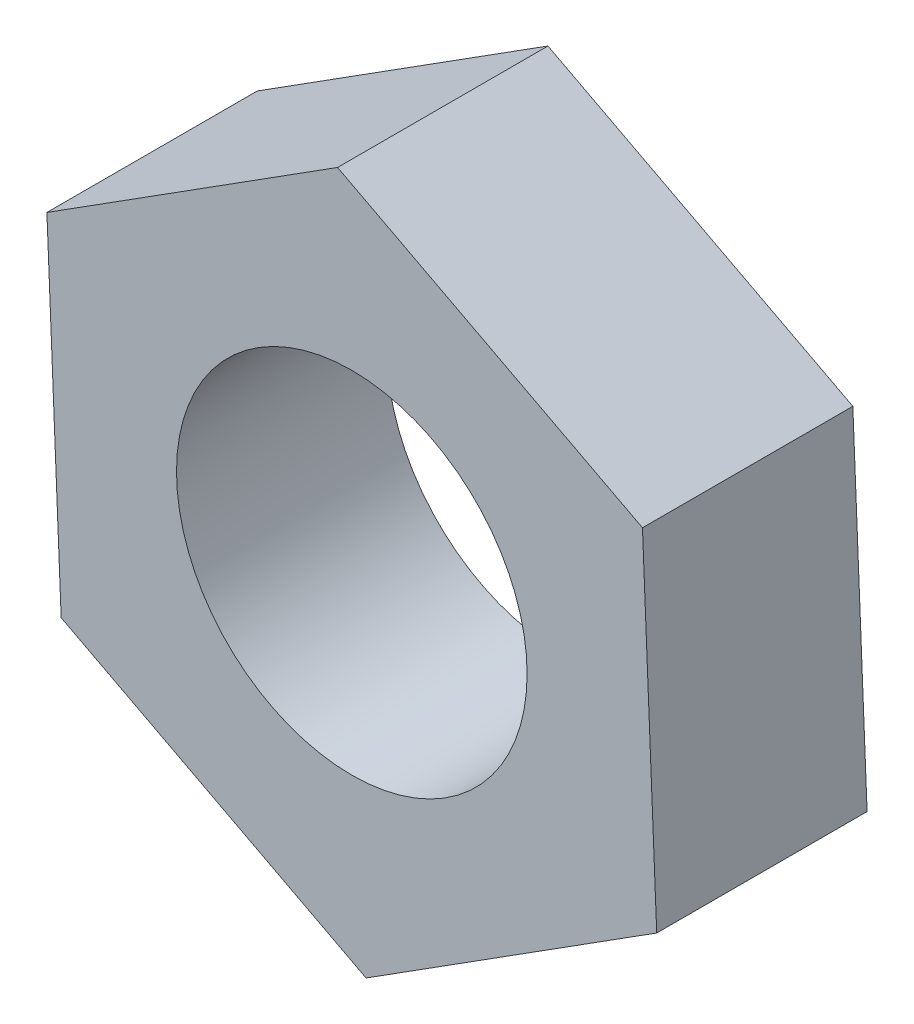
SolidWorks part; units mm, degrees
ref_plane "前基準面" through (0, 0, 0) normal (0, 0, 1) x (1, 0, 0)
ref_plane "上基準面" through (0, 0, 0) normal (0, 1, 0) x (1, 0, 0)
ref_plane "右基準面" through (0, 0, 0) normal (1, 0, 0) x (0, 0, -1)
sketch "草圖1" plane through (0, 0, 0) normal (0, 0, 1) x (1, 0, 0)
  line L1 (8.696, -4.5512) -> (8.2894, 5.2554)
  line L2 (8.2894, 5.2554) -> (-0.4066, 9.8065)
  line L3 (-0.4066, 9.8065) -> (-8.696, 4.5512)
  line L4 (-8.696, 4.5512) -> (-8.2894, -5.2554)
  line L5 (-8.2894, -5.2554) -> (0.4066, -9.8065)
  line L6 (0.4066, -9.8065) -> (8.696, -4.5512)
  circle A0 centre (0, 0) radius 8.5 construction
  dimension "D1" = 17
extrude "填料-伸長1" add sketch "草圖1" along normal blind 6
hole_wizard "M10x1.0 螺紋孔1" positions "草圖3" profile "草圖2" tap size "M10x1.0" standard "ISO"
sketch "草圖3" plane through (0, 0, 6) normal (0, 0, 1) x (1, 0, 0)
  point P0 (0, 0)
sketch "草圖2" plane through (0, 0, 6) normal (1, 0, 0) x (0, -1, 0)
  line L0 (0, 0) -> (0, 27.7039)
  line L1 (0, 27.7039) -> (4.5, 25)
  line L2 (4.5, 25) -> (4.5, 20)
  line L3 (4.5, 20) -> (5, 20)
  line L4 (5, 20) -> (5, 0)
  line L5 (5, 0) -> (0, 0)
  line L10 (0, 27.7039) -> (-4.5, 25) construction
  line L11 (0, -6.35) -> (0, 107.95) construction
  dimension "螺孔鑽直徑" = 9
  dimension "螺孔鑽深度" = 25
  dimension "螺紋主直徑" = 10
  dimension "螺紋深度" = 20
  dimension "導頭角度" = 118
